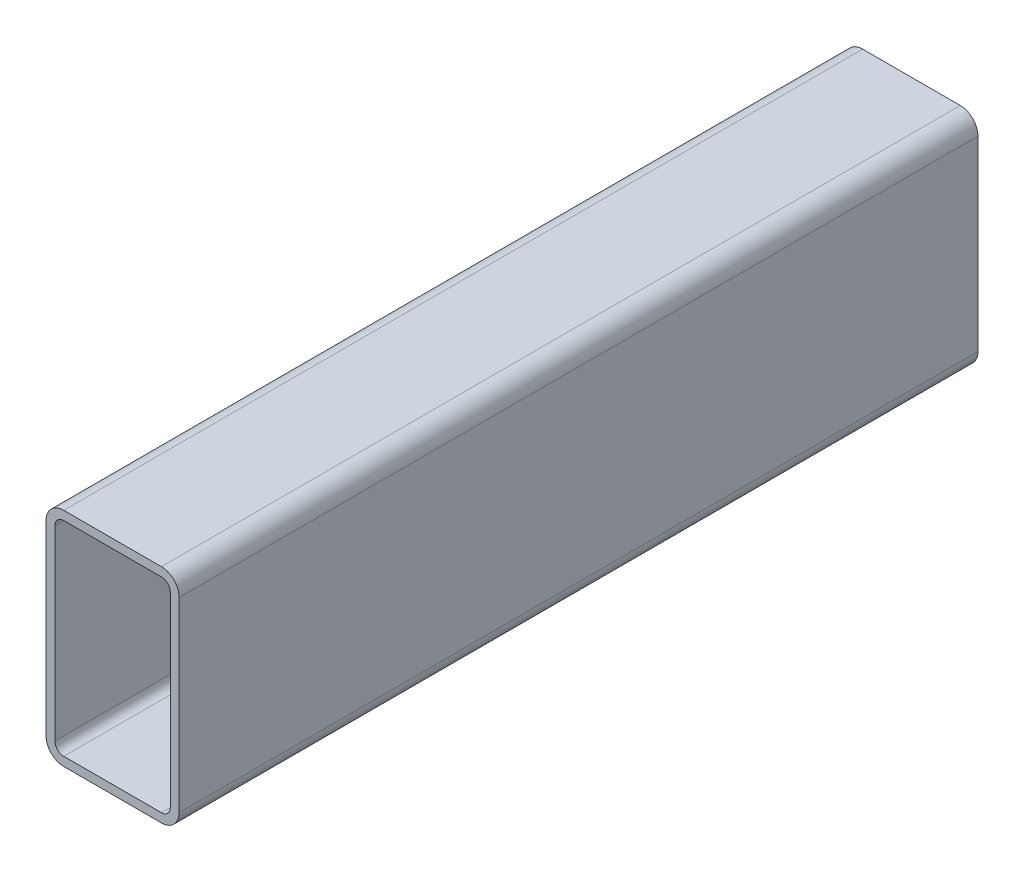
SolidWorks part; units mm, degrees
ref_plane "Plan de face" through (0, 0, 0) normal (0, 0, 1) x (1, 0, 0)
ref_plane "Plan de dessus" through (0, 0, 0) normal (0, 1, 0) x (1, 0, 0)
ref_plane "Plan de droite" through (0, 0, 0) normal (1, 0, 0) x (0, 0, -1)
sketch "Esquisse1" plane through (0, 0, 0) normal (0, 0, 1) x (1, 0, 0)
  line L0 (20, 0) -> (130, 0)
  line L1 (150, 20) -> (150, 230)
  line L2 (130, 250) -> (20, 250)
  line L3 (0, 230) -> (0, 20)
  line L4 (130, 240) -> (20, 240)
  line L5 (10, 230) -> (10, 20)
  line L6 (20, 10) -> (130, 10)
  line L7 (140, 20) -> (140, 230)
  arc A0 (130, 0) -> (150, 20) centre (130, 20) ccw
  arc A1 (150, 230) -> (130, 250) centre (130, 230) ccw
  arc A2 (20, 250) -> (0, 230) centre (20, 230) ccw
  arc A3 (0, 20) -> (20, 0) centre (20, 20) ccw
  arc A4 (20, 240) -> (10, 230) centre (20, 230) ccw
  arc A5 (10, 20) -> (20, 10) centre (20, 20) ccw
  arc A6 (130, 10) -> (140, 20) centre (130, 20) ccw
  arc A7 (140, 230) -> (130, 240) centre (130, 230) ccw
  dimension "D3" = 20
  dimension "D1" = 250
  dimension "D2" = 150
  dimension "D4" = 10
extrude "Extrusion1" add sketch "Esquisse1" along normal mid plane 900
